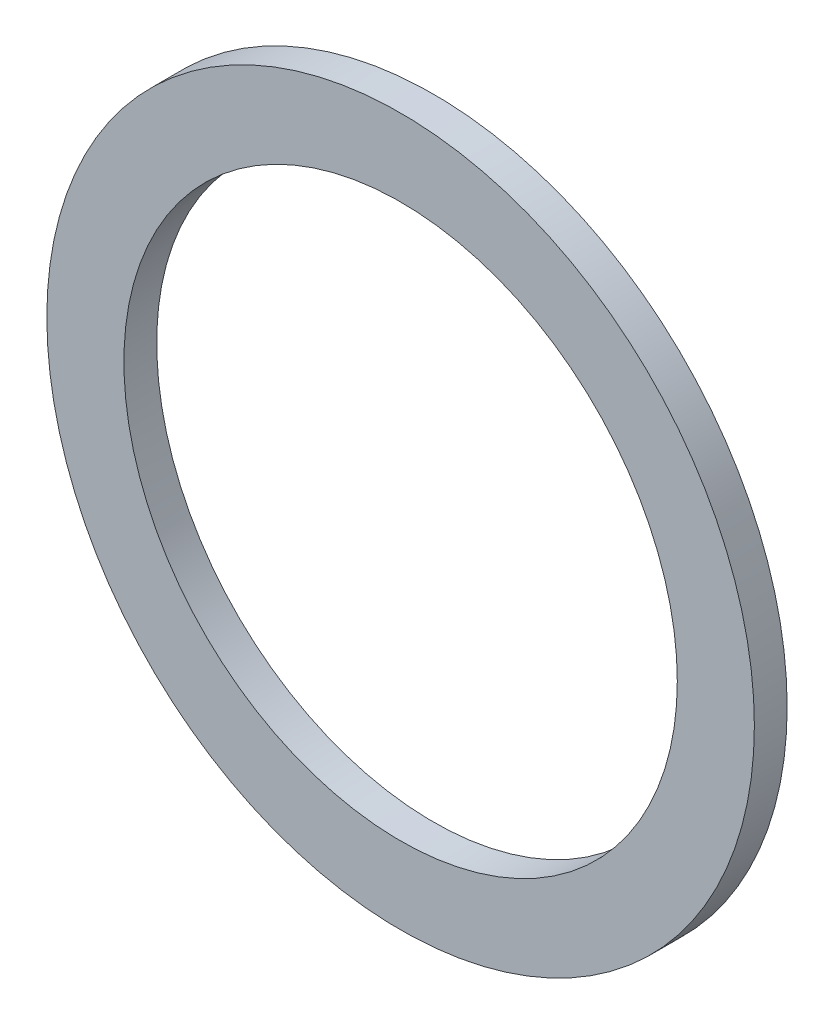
SolidWorks part; units mm, degrees
ref_plane "Front" through (0, 0, 0) normal (0, 0, 1) x (1, 0, 0)
ref_plane "Top" through (0, 0, 0) normal (0, 1, 0) x (1, 0, 0)
ref_plane "Right" through (0, 0, 0) normal (1, 0, 0) x (0, 0, -1)
sketch "Sketch1" plane through (0, 0, 0) normal (0, 0, 1) x (1, 0, 0)
  circle A0 centre (0, 0) radius 10.9601
  dimension "D1" = 21.9202
extrude "Extrude-Thin1" add sketch "Sketch1" along normal blind 1.016 thin
